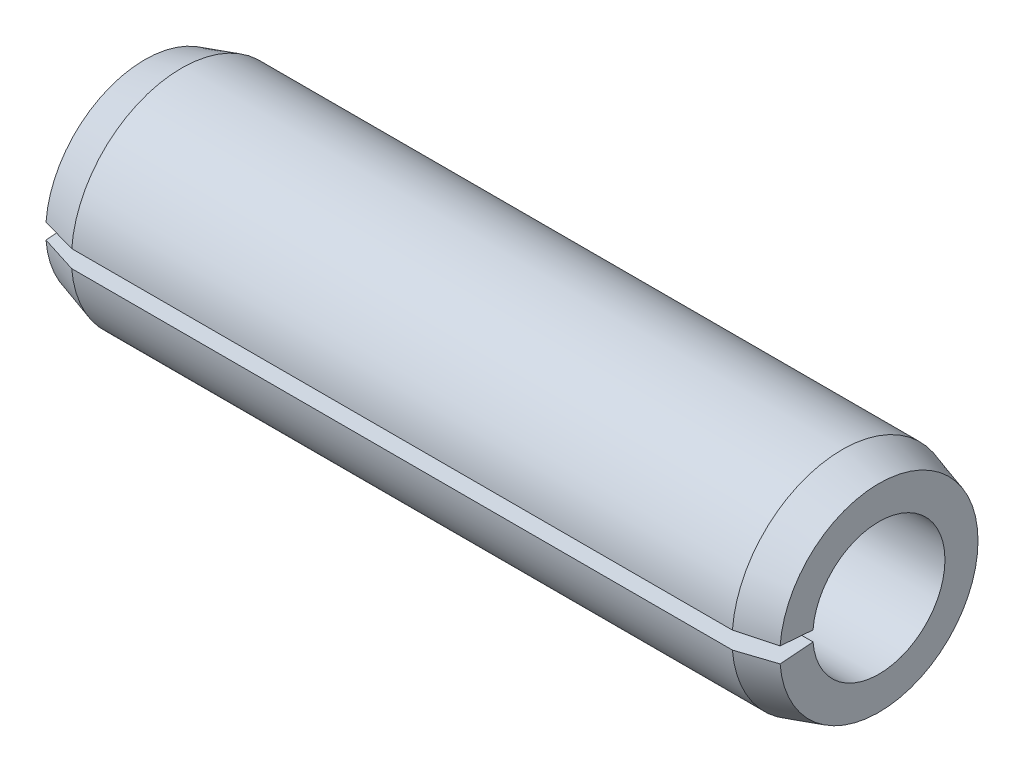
SolidWorks part; units mm, degrees
ref_plane "Plane1" through (0, 0, 0) normal (0, 0, 1) x (1, 0, 0)
ref_plane "Plane2" through (0, 0, 0) normal (0, 1, 0) x (1, 0, 0)
ref_plane "Plane3" through (0, 0, 0) normal (1, 0, 0) x (0, 0, -1)
sketch "Sketch1" plane through (0, 0, 0) normal (0, 0, 1) x (1, 0, 0)
  line L0 (-9.525, 0) -> (111.125, 0) construction
  line L1 (0, 0.9) -> (10, 0.9)
  line L2 (10, 0.9) -> (10, 1.35)
  line L3 (10, 1.35) -> (9.5, 1.5)
  line L4 (9.5, 1.5) -> (0.5, 1.5)
  line L5 (0.5, 1.5) -> (0, 1.35)
  line L7 (0, 1.35) -> (0, 0.9)
revolve "Base-Revolve" add sketch "Sketch1" angle 360 about L0
sketch "Sketch2" plane through (0, 0, 0) normal (-1, 0, 0) x (0, -1, 0)
  line L0 (0, 0) -> (0.12, 1.5253)
  line L1 (0, -3.175) -> (0, 12.7) construction
  line L2 (0, 0) -> (-0.12, 1.5253)
  arc A0 (0.12, 1.5253) -> (-0.12, 1.5253) centre (0, 0) ccw
extrude "Gap" cut sketch "Sketch2" against normal through all
equation "\"D1@Sketch2\" = \"Diameter@Sketch1\" * 0.51"
equation "\"D1@Sketch1\" = \"Diameter@Sketch1\" -  ( \"Thickness@Sketch1\" / 2 ) "
equation "\"D2@Sketch1\" = \"D1@Sketch1\""
equation "\"D3@Sketch1\" = \"Chamfer_len@Sketch1\""
